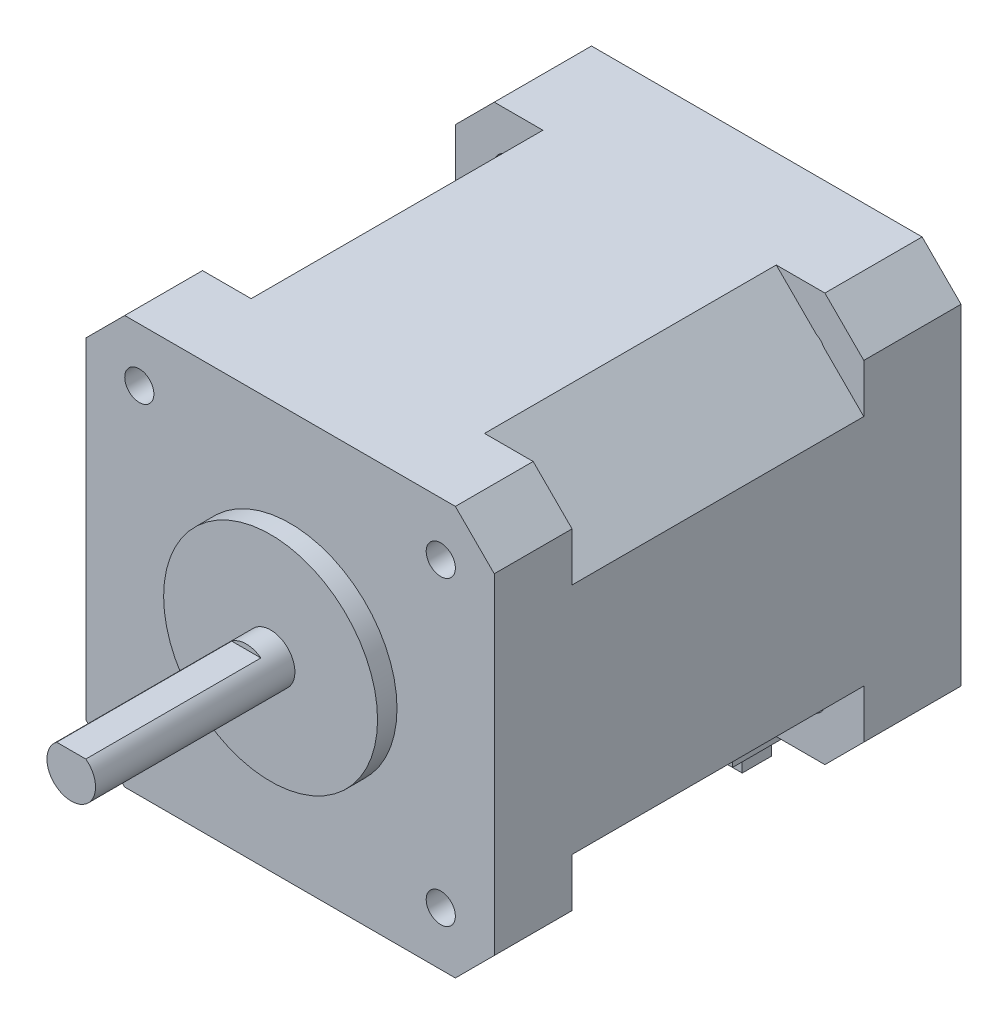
SolidWorks part; units mm, degrees
ref_plane "Front Plane" through (0, 0, 0) normal (0, 0, 1) x (1, 0, 0)
ref_plane "Top Plane" through (0, 0, 0) normal (0, 1, 0) x (1, 0, 0)
ref_plane "Right Plane" through (0, 0, 0) normal (1, 0, 0) x (0, 0, -1)
sketch "Sketch1" plane through (0, 0, 0) normal (0, 0, 1) x (1, 0, 0)
  line L0 (-1.5, 2) -> (1.5, 2)
  arc A0 (-1.5, 2) -> (1.5, 2) centre (0, 0) ccw
  point P5 (0, -2.5)
  dimension "D1" = 5
  dimension "D2" = 4.5
extrude "Boss-Extrude1" add sketch "Sketch1" against normal blind 18
sketch "Sketch2" plane through (0, 0, -18) normal (0, 0, -1) x (-1, 0, 0)
  circle A0 centre (0, 0) radius 2.5
extrude "Boss-Extrude2" add sketch "Sketch2" along normal blind 4.5
sketch "Sketch3" plane through (0, 0, -22.5) normal (0, 0, -1) x (-1, 0, 0)
  circle A0 centre (0, 0) radius 11
  dimension "D1" = 22
extrude "Boss-Extrude3" add sketch "Sketch3" against normal blind 2
sketch "Sketch4" plane through (0, 0, -22.5) normal (0, 0, -1) x (-1, 0, 0)
  line L0 (17, -21) -> (21, -17)
  line L1 (-17, 21) -> (17, 21)
  line L2 (-21, 17) -> (-21, -17)
  line L3 (-17, -21) -> (17, -21)
  line L4 (21, 17) -> (21, -17)
  line L5 (-21, 21) -> (21, -21) construction
  line L6 (-21, -21) -> (21, 21) construction
  line L7 (17, 21) -> (21, 17)
  line L8 (-21, 17) -> (-17, 21)
  line L9 (-21, -17) -> (-17, -21)
  line L11 (-15.5, -15.5) -> (15.5, -15.5)
  line L12 (-15.5, -15.5) -> (-15.5, 15.5)
  line L13 (-15.5, 15.5) -> (15.5, 15.5)
  line L14 (15.5, -15.5) -> (15.5, 15.5)
  line L15 (-15.5, -15.5) -> (15.5, 15.5) construction
  line L16 (-15.5, 15.5) -> (15.5, -15.5) construction
  circle A0 centre (-15.5, 15.5) radius 1.5
  circle A1 centre (15.5, 15.5) radius 1.5
  circle A2 centre (15.5, -15.5) radius 1.5
  circle A3 centre (-15.5, -15.5) radius 1.5
  point P0 (0, 0)
  point P14 (0, 0)
  dimension "D5" = 3
  dimension "D6" = 3
  dimension "D7" = 3
  dimension "D8" = 3
  dimension "D1" = 42
  dimension "D2" = 42
  dimension "D3" = 31
  dimension "D4" = 31
extrude "Boss-Extrude4" add sketch "Sketch4" along normal blind 48 contours L2 L9 L3 L0 L4 L7 L1 L8 A3 L12 A0 L13 A1 L14 A2 L11 | A3 L11 A2 L14 A1 L13 A0 L12 M11 | M11
sketch "Sketch5" plane through (0, 0, -70.5) normal (0, 0, -1) x (-1, 0, 0)
  line L0 (21, -12) -> (12, -21)
  line L5 (21, -21) -> (16.5, -16.5) construction
  line L6 (21, 21) -> (16.5, 16.5) construction
  line L7 (21, 12) -> (12, 21)
  line L8 (-12, 21) -> (-21, 12)
  line L9 (-12, -21) -> (-21, -12)
  line L10 (-21, 12) -> (-21, 21)
  line L11 (21, -21) -> (12, -21)
  line L12 (21, -21) -> (21, -12)
  line L13 (21, 21) -> (12, 21)
  line L14 (-21, -21) -> (-21, -12)
  line L15 (21, -21) -> (16.5, -16.5) construction
  line L16 (21, 21) -> (16.5, 16.5) construction
  line L17 (-16.5, -16.5) -> (-21, -21) construction
  line L18 (-16.5, -16.5) -> (-21, -21) construction
  line L19 (-16.5, 16.5) -> (-21, 21) construction
  line L20 (-16.5, 16.5) -> (-21, 21) construction
  line L21 (21, 12) -> (21, 21)
  line L22 (-12, 21) -> (-21, 21)
  line L23 (-12, -21) -> (-21, -21)
  point P0 (0, 0)
  point P14 (0, 0)
  dimension "D1" = 42
  dimension "D2" = 42
  dimension "D3" = 42
  dimension "D4" = 42
extrude "Cut-Extrude1" cut sketch "Sketch5" against normal blind 30 from offset 10
sketch "Sketch6" plane through (0, 0, -70.5) normal (0, 0, -1) x (-1, 0, 0)
  line L0 (16.1464, -16.8536) -> (12, -21) construction
  line L1 (21, -12) -> (16.8536, -16.1464) construction
  line L2 (16.1464, -16.8536) -> (12, -21)
  line L3 (21, -12) -> (16.8536, -16.1464)
  line L4 (-12, -21) -> (-16.1464, -16.8536) construction
  line L5 (-16.8536, -16.1464) -> (-21, -12) construction
  line L6 (-12, -21) -> (-16.1464, -16.8536)
  line L7 (-16.8536, -16.1464) -> (-21, -12)
  line L8 (16.8536, 16.1464) -> (21, 12) construction
  line L9 (12, 21) -> (16.1464, 16.8536) construction
  line L10 (16.8536, 16.1464) -> (21, 12)
  line L11 (12, 21) -> (16.1464, 16.8536)
  line L12 (-16.1464, 16.8536) -> (-12, 21) construction
  line L13 (-21, 12) -> (-16.8536, 16.1464) construction
  line L14 (-16.1464, 16.8536) -> (-12, 21)
  line L15 (-21, 12) -> (-16.8536, 16.1464)
  line L16 (12, 21) -> (-12, 21)
  line L17 (-21, -12) -> (-21, 12)
  line L18 (21, -12) -> (21, 12)
  line L19 (12, -21) -> (-12, -21)
  line L20 (-16.1464, 16.8536) -> (-16.8536, 16.1464)
  line L21 (16.8536, 16.1464) -> (16.1464, 16.8536)
  line L22 (16.1464, -16.8536) -> (16.8536, -16.1464)
  line L23 (-16.1464, -16.8536) -> (-16.8536, -16.1464)
  point P10 (18.9268, 14.0732)
extrude "Boss-Extrude5" add sketch "Sketch6" against normal offset from surface (43.5 mm away) 4.5
sketch "Sketch7" plane through (0, 0, -70.5) normal (0, 0, -1) x (-1, 0, 0)
  line L0 (-17, -21) -> (17, -21) construction
  line L1 (-7.5, -16) -> (7.5, -16)
  line L2 (-7.5, -16) -> (-7.5, -26)
  line L3 (-7.5, -26) -> (7.5, -26)
  line L4 (7.5, -16) -> (7.5, -26)
  line L5 (-7.5, -16) -> (7.5, -26) construction
  line L6 (-7.5, -26) -> (7.5, -16) construction
  point P0 (0, -21)
  dimension "D1" = 15
  dimension "D2" = 10
extrude "Boss-Extrude6" add sketch "Sketch7" against normal up to surface (10 mm away)
sketch "Sketch8" plane through (0, 0, -60.5) normal (0, 0, 1) x (1, 0, 0)
  line L0 (7.5, -26) -> (-7.5, -26) construction
  line L1 (-5.5, -26) -> (5.5, -26)
  line L2 (-5.5, -26) -> (-5.5, -21)
  line L3 (-5.5, -21) -> (5.5, -21)
  line L4 (5.5, -26) -> (5.5, -21)
  line L5 (-7.5, -21) -> (7.5, -21) construction
  line L6 (-7.5, -26) -> (-7.5, -21) construction
  line L7 (7.5, -21) -> (7.5, -26) construction
  dimension "D1" = 2
  dimension "D2" = 2
extrude "Cut-Extrude2" cut sketch "Sketch8" against normal blind 5
sketch "Sketch9" plane through (0, -21, 0) normal (0, -1, 0) x (1, 0, 0)
  line L0 (5.5, -65.5) -> (-5.5, -65.5) construction
  line L1 (-4.5, -65.5) -> (4.5, -65.5)
  line L2 (-4.5, -65.5) -> (-4.5, -62.5)
  line L3 (-4.5, -62.5) -> (4.5, -62.5)
  line L4 (4.5, -65.5) -> (4.5, -62.5)
  line L5 (5.5, -65.5) -> (5.5, -60.5) construction
  line L6 (-5.5, -65.5) -> (-5.5, -60.5) construction
  line L8 (-3.5, -62.5) -> (-2.5, -62.5)
  line L9 (-3.5, -62.5) -> (-3.5, -64.8314)
  line L10 (-3.5, -64.8314) -> (-2.5, -64.8314)
  line L11 (-2.5, -62.5) -> (-2.5, -64.8314)
  line L12 (-1.5, -62.5) -> (-0.5, -62.5)
  line L13 (-1.5, -62.5) -> (-1.5, -64.8314)
  line L14 (-1.5, -64.8314) -> (-0.5, -64.8314)
  line L15 (-0.5, -62.5) -> (-0.5, -64.8314)
  line L16 (0.5, -62.5) -> (1.5, -62.5)
  line L17 (0.5, -62.5) -> (0.5, -64.8314)
  line L18 (0.5, -64.8314) -> (1.5, -64.8314)
  line L19 (1.5, -62.5) -> (1.5, -64.8314)
  line L20 (2.5, -62.5) -> (3.5, -62.5)
  line L21 (2.5, -62.5) -> (2.5, -64.8314)
  line L22 (2.5, -64.8314) -> (3.5, -64.8314)
  line L23 (3.5, -62.5) -> (3.5, -64.8314)
  point P6 (4.5, -64)
  point P27 (1.5, -63.6657)
  dimension "D1" = 3
  dimension "D2" = 1
  dimension "D3" = 1
  dimension "D4" = 1
  dimension "D5" = 1
  dimension "D6" = 1
  dimension "D7" = 1
  dimension "D8" = 1
  dimension "D9" = 1
  dimension "D10" = 1
  dimension "D11" = 1
extrude "Boss-Extrude7" add sketch "Sketch9" along normal blind 6 contours L3 L23 L22 L21 L19 L18 L17 L15 L14 L13 L11 L10 L9 L2 L4 M15
sketch "Sketch10" plane through (0, -27, 0) normal (0, -1, 0) x (1, 0, 0)
  line L2 (-4.5, -64.8314) -> (-4.5, -62.5)
  line L3 (-4.5, -62.5) -> (-6.5, -62.5)
  line L4 (-6.5, -65.5) -> (-6.5, -62.5)
  line L6 (-4.5, -62.5) -> (-4.5, -64.8314)
  line L10 (6.5, -62.5) -> (4.5, -62.5)
  line L11 (6.5, -62.5) -> (6.5, -65.5)
  line L12 (4.5, -62.5) -> (4.5, -64.8314)
  line L14 (-4.5, -64.8314) -> (4.5, -64.8314)
  line L15 (-6.5, -65.5) -> (6.5, -65.5)
  dimension "D1" = 2
  dimension "D2" = 2
extrude "Boss-Extrude9" add sketch "Sketch10" along normal blind 1 and the other way blind 6 contours L4 L15 L3 M22 | L14 M22 M23 M24 M7 M11 M15 M19 | L15 L11 L10 M24 | L2
